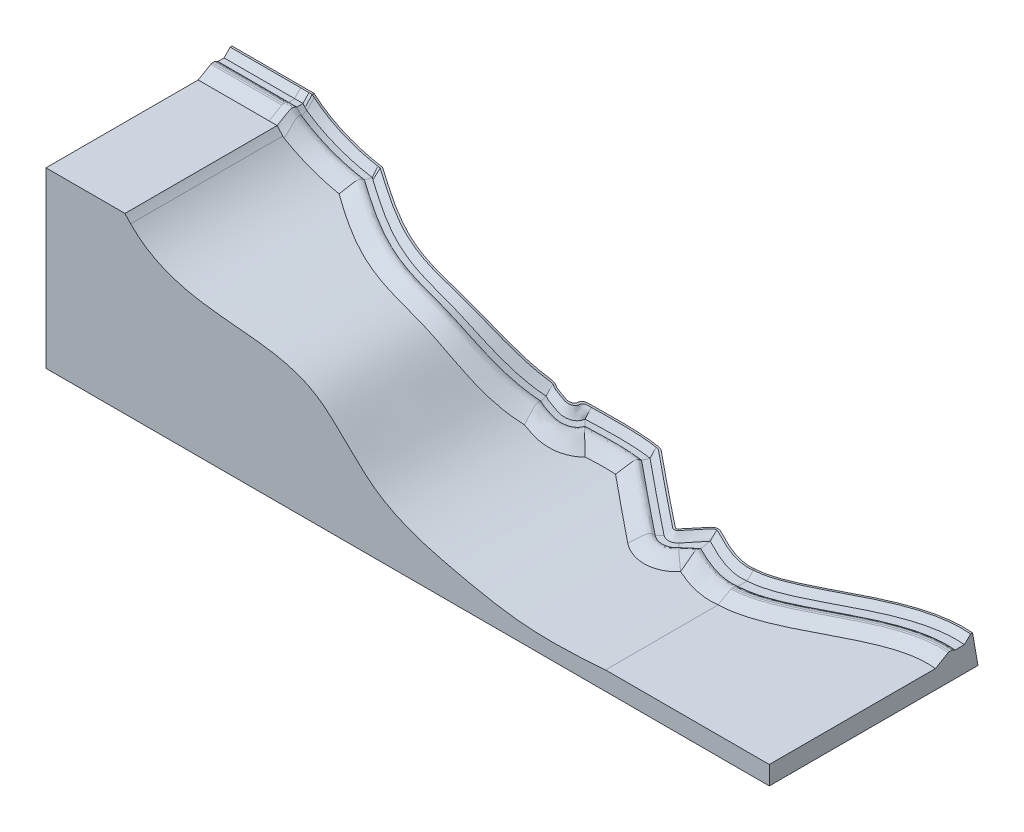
SolidWorks part; units mm, degrees
ref_plane "Ebene vorne" through (0, 0, 0) normal (0, 0, 1) x (1, 0, 0)
ref_plane "Ebene oben" through (0, 0, 0) normal (0, 1, 0) x (1, 0, 0)
ref_plane "Ebene rechts" through (0, 0, 0) normal (1, 0, 0) x (0, 0, -1)
imported_body "Imported1"
sketch "Skizze1" plane through (0, 10, 0) normal (0, 1, 0) x (1, 0, 0)
  line L0 (123.9386, 53.5483) -> (123.9386, 0) construction
  line L1 (71.135, 0) -> (123.9386, 0) construction
  line L2 (123.9386, 64.9193) -> (123.9386, 65.5214)
  line L3 (71.135, 48.2509) -> (71.135, 47.6501)
  line L4 (123.9386, 64.9193) -> (123.9386, 65.5214)
  line L5 (71.135, 48.2509) -> (71.135, 47.6501)
  line L6 (71.135, 0) -> (71.135, 47.6501) construction
  line L7 (123.9386, 57.6612) -> (123.9386, 53.5483) construction
  line L8 (123.9386, 57.6612) -> (123.9386, 58.163) construction
  line L9 (123.9386, 58.7632) -> (123.9386, 58.163) construction
  line L10 (123.9386, 58.7632) -> (123.9386, 59.265) construction
  line L11 (123.9386, 59.9013) -> (123.9386, 59.265) construction
  line L12 (123.9386, 62.9121) -> (123.9386, 59.9013) construction
  line L13 (123.9386, 64.9193) -> (123.9386, 62.9121) construction
  line L14 (123.9386, 53.5483) -> (123.9386, 0)
  line L15 (71.135, 0) -> (123.9386, 0)
  line L17 (123.9386, 57.6612) -> (123.9386, 53.5483)
  line L18 (123.9386, 57.6612) -> (123.9386, 58.163)
  line L19 (123.9386, 58.7632) -> (123.9386, 58.163)
  line L20 (123.9386, 58.7632) -> (123.9386, 59.265)
  line L21 (123.9386, 59.9013) -> (123.9386, 59.265)
  line L22 (123.9386, 62.9121) -> (123.9386, 59.9013)
  line L23 (123.9386, 64.9193) -> (123.9386, 62.9121)
  line L24 (71.135, 0) -> (71.135, 47.6501)
  spline S2 degree 3 poles (-893.4262, -2740.0063) (356.6354, -148.1156) (193.7863, 72.1931) (114.3015, 65.1888) (110.9592, 64.4009) (104.6442, 62.3469) (101.6631, 61.0794) (95.9651, 58.4023) (93.2467, 56.9903) (88.0371, 54.296) (85.5456, 53.0139) (80.8288, 50.8267) (78.605, 49.9248) (75.5485, 48.9856) (74.5767, 48.7405) (-2.8755, 34.0146) (275.7695, 501.2328) (-2867.1672, -415.4584) knots 0.127335 0.127335 0.127335 0.127335 0.799406 0.799406 0.830656 0.830656 0.861906 0.861906 0.893156 0.893156 0.924406 0.924406 0.955656 0.955656 0.971281 0.971281 2.269776 2.269776 2.269776 2.269776 only from (123.9386, 65.5214) to (71.135, 48.2509)
  spline S3 degree 3 poles (400.0002, 992.0245) (171.8435, 373.8027) (3.0518, 28.7539) (76.5386, 48.6505) (77.3941, 48.9215) (79.1598, 49.5481) (80.0698, 49.9038) (82.8715, 51.082) (84.8338, 52.0178) (88.9088, 54.0619) (91.0231, 55.17) (95.3948, 57.4165) (97.6551, 58.5539) (102.3449, 60.7065) (104.7754, 61.7202) (109.8566, 63.4408) (112.511, 64.1504) (165.1256, 72.3716) (255.9848, -9.695) (98.5967, -934.723) knots -5.379756 -5.379756 -5.379756 -5.379756 0.125 0.125 0.1875 0.1875 0.25 0.25 0.375 0.375 0.5 0.5 0.625 0.625 0.75 0.75 0.875 0.875 3.120839 3.120839 3.120839 3.120839 only from (71.135, 47.6501) to (123.9386, 64.9193)
  spline S4 degree 3 poles (123.9386, 65.5214) (121.8619, 65.6948) (119.8179, 65.6749) (114.3015, 65.1888) (110.9592, 64.4009) (104.6442, 62.3469) (101.6631, 61.0794) (95.9651, 58.4023) (93.2467, 56.9903) (88.0371, 54.296) (85.5456, 53.0139) (80.8288, 50.8267) (78.605, 49.9248) (75.5485, 48.9856) (74.5767, 48.7405) (72.7699, 48.397) (71.9316, 48.2931) (71.135, 48.2509) knots 0.781844 0.781844 0.781844 0.781844 0.799406 0.799406 0.830656 0.830656 0.861906 0.861906 0.893156 0.893156 0.924406 0.924406 0.955656 0.955656 0.971281 0.971281 0.986312 0.986312 0.986312 0.986312
  dimension "D1" = 0
extrude "Aufsatz-Linear austragen1" [suppressed] add sketch "Skizze1" against normal up to surface (4 mm away)
sketch "Skizze2" plane through (-109.2515, 0, 0) normal (-1, 0, 0) x (0, 0, 1)
  line L0 (-59.4, 60) -> (-60, 60)
  line L1 (-60, 60) -> (-60, 70)
  line L2 (-60, 70) -> (0, 70)
  line L3 (0, 70) -> (0, 60) construction
  line L4 (0, 56) -> (10, 56)
  line L5 (0, 70) -> (10, 70)
  line L6 (10, 70) -> (10, 56)
  line L8 (0, 56) -> (0, 60)
  line L9 (0, 60) -> (-59.4, 60)
  line L10 (-59.4, 60) -> (-57.4, 58)
  line L11 (-57.4, 58) -> (-55.4, 58)
  line L12 (-55.4, 58) -> (-54.766, 58.366)
  line L13 (-54.266, 58.5) -> (-53.6639, 58.5)
  line L14 (-53.1639, 58.366) -> (-49.0658, 56)
  line L15 (-49.0658, 56) -> (0, 56)
  line L16 (0, 56) -> (0, 60) construction
  line L17 (0, 60) -> (-59.4, 60) construction
  line L18 (-59.4, 60) -> (-57.4, 58)
  line L19 (-57.4, 58) -> (-55.4, 58)
  line L20 (-55.4, 58) -> (-54.766, 58.366)
  line L21 (-54.266, 58.5) -> (-53.6639, 58.5)
  line L22 (-53.1639, 58.366) -> (-49.0658, 56)
  line L23 (-49.0658, 56) -> (0, 56)
  arc A2 (-54.266, 58.5) -> (-54.766, 58.366) centre (-54.266, 57.5) ccw
  arc A3 (-53.1639, 58.366) -> (-53.6639, 58.5) centre (-53.6639, 57.5) ccw
  arc A4 (-54.266, 58.5) -> (-54.766, 58.366) centre (-54.266, 57.5) ccw
  arc A5 (-53.1639, 58.366) -> (-53.6639, 58.5) centre (-53.6639, 57.5) ccw
  dimension "D2" = 10
  dimension "D3" = 10
  dimension "D1" = 0
sketch3d "3D-Skizze1"
  line L0 (-109.2515, 60, -60) -> (-82.8362, 60, -60) construction
  line L1 (-109.2515, 60, -60) -> (-82.8362, 60, -60) construction
  spline S0 degree 3 poles (-1724.8086, -1000.7875, -247.0455) (610.0026, 1277.6327, 154.7015) (-202.4645, 161.8963, -42.0329) (-78.0357, 55.1095, -60.8623) (-77.2594, 54.5085, -60.9683) (-75.6387, 53.3799, -61.1673) (-74.7903, 52.8505, -61.2606) (-72.1971, 51.3994, -61.5165) (-70.3924, 50.6044, -61.6567) (-1.1166, 26.0474, -65.9868) (149.5272, 177.3713, -39.3043) (-1699.9642, -1082.5382, -261.4603) knots -20.569023 -20.569023 -20.569023 -20.569023 0.25 0.25 0.375 0.375 0.5 0.5 0.75 0.75 9.792761 9.792761 9.792761 9.792761 only from (-82.8362, 60, -60) to (-62.7908, 48.33, -62.0577) construction
  spline S1 degree 3 poles (-672.2557, 1620.0494, 1006.5175) (-161.4054, 104.3023, -158.2626) (-117.1067, 54.58, -96.087) (-52.5987, 46.7722, -55.5935) (-50.0067, 46.5375, -54.0238) (-46.0108, 46.1717, -51.8759) (-44.6607, 46.0475, -51.1947) (-41.9112, 45.7679, -49.9326) (-40.5119, 45.6128, -49.3515) (-38.3644, 45.3299, -48.5834) (-37.6404, 45.2271, -48.3447) (-36.1739, 44.9982, -47.9078) (-35.4303, 44.8718, -47.7096) (-33.2078, 44.4542, -47.1934) (-31.7259, 44.1233, -46.9506) (-29.5097, 43.5081, -46.758) (-28.7722, 43.2832, -46.7223) (-27.6695, 42.91, -46.7089) (-27.3016, 42.7793, -46.7111) (-26.5733, 42.507, -46.7284) (-26.2128, 42.3656, -46.7433) (-24.4294, 41.6303, -46.8473) (-23.0633, 40.9524, -47.0234) (-21.1121, 39.7776, -47.389) (-20.4778, 39.3601, -47.5279) (-19.2355, 38.4827, -47.8332) (-18.6284, 38.0232, -47.9997) (-16.8591, 36.6124, -48.5267) (-15.7397, 35.6232, -48.9165) (-13.5622, 33.6025, -49.7504) (-12.5044, 32.5706, -50.1947) (-10.4061, 30.5095, -51.1283) (-9.3657, 29.4801, -51.6176) (-7.2642, 27.4659, -52.6401) (-6.2032, 26.4811, -53.1735) (36.5514, -10.4484, -74.9357) (120.6982, 16.2952, -127.0429) (1490.8942, 1337.3212, 126.6217) knots -2.897233 -2.897233 -2.897233 -2.897233 0.125 0.125 0.25 0.25 0.3125 0.3125 0.375 0.375 0.40625 0.40625 0.4375 0.4375 0.5 0.5 0.53125 0.53125 0.546875 0.546875 0.5625 0.5625 0.625 0.625 0.65625 0.65625 0.6875 0.6875 0.75 0.75 0.8125 0.8125 0.875 0.875 0.9375 0.9375 3.326194 3.326194 3.326194 3.326194 only from (-62.7908, 48.33, -62.0577) to (-1.7331, 22.8655, -55.4505) construction
  spline S2 degree 3 poles (-1591.8235, 1042.4032, 591.579) (31.2175, 8.6291, 44.5751) (9.3574, 15.334, -56.0347) (-12.2395, 29.9774, -55.1997) (-20.6228, 45.0697, 62.0287) (1615.4495, -1149.5559, -97.8972) knots -21.324735 -21.324735 -21.324735 -21.324735 0.5 0.5 24.016037 24.016037 24.016037 24.016037 only from (-0.3256, 21.9112, -55.4972) to (-1.7331, 22.8655, -55.4505) construction
  spline S3 degree 3 poles (-1578.8474, 1137.8018, -551.4692) (1660.1021, -1118.0098, 168.6098) (-1681.5525, 1148.5191, -5.0975) (1647.2486, -1058.216, -381.5366) knots -46.397349 -46.397349 -46.397349 -46.397349 46.557012 46.557012 46.557012 46.557012 only from (0.5808, 21.3438, -55.3074) to (-0.3256, 21.9112, -55.4972) construction
  spline S4 degree 3 poles (-1002.7758, -1703.4354, -55.3074) (1318.6069, 1676.5782, -55.3074) (-1231.3353, -1668.6477, -55.3074) (938.5047, 1783.4542, -55.3074) knots -91.071429 -91.071429 -91.071429 -91.071429 74.888943 74.888943 74.888943 74.888943 only from (3.0081, 19.9804, -55.3074) to (0.5808, 21.3438, -55.3074) construction
  spline S5 degree 3 poles (-1785.339, 774.9633, -528.7279) (-148.6449, 90.4377, -124.6916) (8.2407, 17.5058, -71.4152) (4.9217, 19.0413, -56.7342) (4.8781, 19.0614, -56.6044) (4.7673, 19.1131, -56.3593) (4.7007, 19.1443, -56.2447) (4.5465, 19.217, -56.0303) (4.4591, 19.2585, -55.9315) (4.1772, 19.3934, -55.6682) (3.9578, 19.5001, -55.5324) (3.6122, 19.672, -55.3978) (3.4924, 19.7322, -55.3637) (-31.7834, 37.6607, -48.7654) (-141.9382, 151.0868, -1004.5748) (360.844, 1325.4839, -1417.1978) knots -13.709798 -13.709798 -13.709798 -13.709798 0.125 0.125 0.25 0.25 0.375 0.375 0.5 0.5 0.75 0.75 0.875 0.875 37.365409 37.365409 37.365409 37.365409 only from (5.0004, 19.0049, -57.2698) to (3.0081, 19.9804, -55.3074) construction
  spline S6 degree 3 poles (1737.7206, -879.0443, 379.1635) (150.8109, -47.0486, 5.6922) (0.1923, 21.2085, -43.1767) (5.1812, 18.9219, -58.1189) (5.2785, 18.8774, -58.3106) (13.6583, 15.0998, -70.3805) (123.2988, -31.4758, 10.1917) (-1271.5166, 758.5332, 1285.3435) knots -17.542614 -17.542614 -17.542614 -17.542614 0.25 0.25 0.5 0.5 17.480468 17.480468 17.480468 17.480468 only from (5.0004, 19.0049, -57.2698) to (6.3523, 18.4047, -59.2678) construction
  spline S7 degree 3 poles (-91.1336, 1574.0859, -1301.8325) (-64.6803, 106.7383, 105.7645) (-51.7348, 34.3702, -44.258) (16.5711, 14.961, -62.7749) (18.1043, 14.5608, -63.1166) (78.7026, -0.4573, -72.9522) (184.8799, -0.616, 43.1568) (-1230.6009, -108.9392, 1480.6441) knots -10.590032 -10.590032 -10.590032 -10.590032 0.5 0.5 0.75 0.75 10.19713 10.19713 10.19713 10.19713 only from (6.3523, 18.4047, -59.2678) to (24.4234, 13.0402, -63.8447) construction
  spline S8 degree 3 poles (572.103, 1881.5387, 361.5736) (285.7609, 168.7382, 138.863) (154.0062, -3.9842, 36.3871) (39.2744, 10.1702, -52.8487) (-72.1864, 26.6863, -139.5404) (-169.4399, 184.7427, -215.182) (-486.3805, -1863.1194, -461.6914) knots -16.236709 -16.236709 -16.236709 -16.236709 0.25 0.25 0.5 16.549555 16.549555 16.549555 16.549555 only from (46.1429, 9.458, -47.5065) to (25.6543, 12.7586, -63.4421) construction
  spline S9 degree 3 poles (1715.5391, -361.7997, 931.2351) (-1790.2179, 417.4327, -846.6813) (1918.7817, -410.8986, 490.0407) (-1900.1316, 445.2076, -371.1473) knots -27.750418 -27.750418 -27.750418 -27.750418 28.854972 28.854972 28.854972 28.854972 only from (24.4234, 13.0402, -63.8447) to (25.6543, 12.7586, -63.4421) construction
  spline S10 degree 3 poles (-1825.6109, 118.4739, 644.1953) (45.8319, 9.8909, -124.5921) (51.4348, 9.1059, -48.0212) (41.6157, 9.7579, -46.7923) (27.9744, 11.0928, -121.7435) (2028.1706, -132.1428, 171.8468) knots -18.529697 -18.529697 -18.529697 -18.529697 0.5 0.5 19.4269 19.4269 19.4269 19.4269 only from (46.8446, 9.4112, -47.5942) to (46.1429, 9.458, -47.5065) construction
  spline S11 degree 3 poles (364.6512, -1893.2814, -456.2028) (210.9132, 1956.3895, -258.5396) (-63.1704, -1946.5223, 93.8536) (-216.2581, 1945.046, 290.6806) knots -73.518441 -73.518441 -73.518441 -73.518441 63.892032 63.892032 63.892032 63.892032 only from (51.5028, 9.2194, -53.5833) to (46.8446, 9.4112, -47.5942) construction
  spline S12 degree 3 poles (1947.9879, -509.7238, 52.9502) (356.3661, 10.5037, 369.7722) (29.1616, 9.5836, -39.433) (52.2211, 9.2065, -54.1842) (52.4372, 9.2035, -54.2751) (52.8994, 9.1983, -54.3807) (53.1342, 9.1963, -54.3925) (76.4568, 9.0628, -51.4224) (-17.8586, 15.7007, 335.6567) (-463.3271, -162.0965, 1869.4805) knots -28.356633 -28.356633 -28.356633 -28.356633 0.25 0.25 0.5 0.5 0.75 0.75 25.324741 25.324741 25.324741 25.324741 only from (51.5028, 9.2194, -53.5833) to (54.037, 9.1929, -54.1528) construction
  spline S13 degree 3 poles (-943.2037, 340.231, 1643.2848) (-35.6217, 39.0037, -168.5126) (-1.4218, 7.648, -81.2749) (59.4832, 9.2849, -51.3986) (60.8659, 9.3391, -50.7587) (62.9854, 9.4441, -49.9006) (63.6995, 9.4831, -49.6314) (65.1496, 9.5688, -49.1419) (65.8825, 9.6154, -48.9235) (67.3571, 9.7148, -48.5651) (68.1003, 9.7678, -48.4238) (183.5978, 18.3563, -34.987) (517.0793, 97.8119, -1406.6739) (351.1977, -1468.2434, 1037.0152) knots -10.623288 -10.623288 -10.623288 -10.623288 0.25 0.25 0.5 0.5 0.625 0.625 0.75 0.75 0.875 0.875 19.956322 19.956322 19.956322 19.956322 only from (54.037, 9.1929, -54.1528) to (71.135, 10, -48.2509) construction
  spline S14 degree 3 poles (-1903.3914, 10, 148.8187) (215.754, 10, -399.0624) (6.0262, 10, -35.707) (74.5767, 10, -48.7405) (75.5485, 10, -48.9856) (78.605, 10, -49.9248) (80.8288, 10, -50.8267) (85.5456, 10, -53.0139) (88.0371, 10, -54.296) (93.2467, 10, -56.9903) (95.9651, 10, -58.4023) (101.6631, 10, -61.0794) (104.6442, 10, -62.3469) (110.9592, 10, -64.4009) (114.3015, 10, -65.1888) (183.7818, 10, -71.3115) (315.2424, 10, 94.0163) (-469.5695, 10, 1834.3413) knots -5.538426 -5.538426 -5.538426 -5.538426 0.073514 0.073514 0.149931 0.149931 0.302767 0.302767 0.455603 0.455603 0.608438 0.608438 0.761274 0.761274 0.91411 0.91411 3.768084 3.768084 3.768084 3.768084 only from (71.135, 10, -48.2509) to (123.9386, 10, -65.5214) construction
  spline S15 degree 3 poles (-82.8362, 60, -60) (-81.6139, 58.4418, -60.2748) (-80.2636, 57.0215, -60.5252) (-78.0357, 55.1095, -60.8623) (-77.2594, 54.5085, -60.9683) (-75.6387, 53.3799, -61.1673) (-74.7903, 52.8505, -61.2606) (-72.1971, 51.3994, -61.5165) (-70.3924, 50.6044, -61.6567) (-66.665, 49.2831, -61.8897) (-64.7377, 48.7563, -61.9826) (-62.7908, 48.33, -62.0577) knots 0 0 0 0 0.25 0.25 0.375 0.375 0.5 0.5 0.75 0.75 1 1 1 1 construction
  spline S16 degree 3 poles (-62.7908, 48.33, -62.0577) (-60.2548, 47.7747, -60.4582) (-57.7229, 47.3924, -58.8101) (-52.5987, 46.7722, -55.5935) (-50.0067, 46.5375, -54.0238) (-46.0108, 46.1717, -51.8759) (-44.6607, 46.0475, -51.1947) (-41.9112, 45.7679, -49.9326) (-40.5119, 45.6128, -49.3515) (-38.3644, 45.3299, -48.5834) (-37.6404, 45.2271, -48.3447) (-36.1739, 44.9982, -47.9078) (-35.4303, 44.8718, -47.7096) (-33.2078, 44.4542, -47.1934) (-31.7259, 44.1233, -46.9506) (-29.5097, 43.5081, -46.758) (-28.7722, 43.2832, -46.7223) (-27.6695, 42.91, -46.7089) (-27.3016, 42.7793, -46.7111) (-26.5733, 42.507, -46.7284) (-26.2128, 42.3656, -46.7433) (-24.4294, 41.6303, -46.8473) (-23.0633, 40.9524, -47.0234) (-21.1121, 39.7776, -47.389) (-20.4778, 39.3601, -47.5279) (-19.2355, 38.4827, -47.8332) (-18.6284, 38.0232, -47.9997) (-16.8591, 36.6124, -48.5267) (-15.7397, 35.6232, -48.9165) (-13.5622, 33.6025, -49.7504) (-12.5044, 32.5706, -50.1947) (-10.4061, 30.5095, -51.1283) (-9.3657, 29.4801, -51.6176) (-7.2642, 27.4659, -52.6401) (-6.2032, 26.4811, -53.1735) (-4.023, 24.5978, -54.2833) (-2.9037, 23.6992, -54.8593) (-1.7331, 22.8655, -55.4505) knots 0 0 0 0 0.125 0.125 0.25 0.25 0.3125 0.3125 0.375 0.375 0.40625 0.40625 0.4375 0.4375 0.5 0.5 0.53125 0.53125 0.546875 0.546875 0.5625 0.5625 0.625 0.625 0.65625 0.65625 0.6875 0.6875 0.75 0.75 0.8125 0.8125 0.875 0.875 0.9375 0.9375 1 1 1 1 construction
  spline S17 degree 3 poles (-0.3256, 21.9112, -55.4972) (-0.5559, 22.0598, -55.5981) (-0.8001, 22.2211, -55.6419) (-1.2764, 22.5441, -55.6235) (-1.5133, 22.7089, -55.5615) (-1.7331, 22.8655, -55.4505) knots 0 0 0 0 0.5 0.5 1 1 1 1 construction
  spline S18 degree 3 poles (0.5808, 21.3438, -55.3074) (0.2693, 21.533, -55.3074) (-0.0384, 21.7258, -55.371) (-0.3256, 21.9112, -55.4972) knots 0 0 0 0 1 1 1 1 construction
  spline S19 degree 3 poles (3.0081, 19.9804, -55.3074) (2.1841, 20.4086, -55.3074) (1.3743, 20.8621, -55.3074) (0.5808, 21.3438, -55.3074) knots 0 0 0 0 1 1 1 1 construction
  spline S20 degree 3 poles (5.0004, 19.0049, -57.2698) (4.9978, 19.0061, -57.1317) (4.9811, 19.0138, -56.9971) (4.9217, 19.0413, -56.7342) (4.8781, 19.0614, -56.6044) (4.7673, 19.1131, -56.3593) (4.7007, 19.1443, -56.2447) (4.5465, 19.217, -56.0303) (4.4591, 19.2585, -55.9315) (4.1772, 19.3934, -55.6682) (3.9578, 19.5001, -55.5324) (3.6122, 19.672, -55.3978) (3.4924, 19.7322, -55.3637) (3.2516, 19.8546, -55.3186) (3.1303, 19.9169, -55.3074) (3.0081, 19.9804, -55.3074) knots 0 0 0 0 0.125 0.125 0.25 0.25 0.375 0.375 0.5 0.5 0.75 0.75 0.875 0.875 1 1 1 1 construction
  spline S21 degree 3 poles (5.0004, 19.0049, -57.2698) (5.0045, 19.003, -57.4911) (5.0429, 18.9852, -57.7049) (5.1812, 18.9219, -58.1189) (5.2785, 18.8774, -58.3106) (5.6433, 18.713, -58.8359) (5.9743, 18.5662, -59.106) (6.3523, 18.4047, -59.2678) knots 0 0 0 0 0.25 0.25 0.5 0.5 1 1 1 1 construction
  spline S22 degree 3 poles (6.3523, 18.4047, -59.2678) (9.1513, 17.209, -60.4657) (12.0535, 16.2447, -61.5503) (16.5711, 14.961, -62.7749) (18.1043, 14.5608, -63.1166) (21.2289, 13.7865, -63.6238) (22.8242, 13.4094, -63.7893) (24.4234, 13.0402, -63.8447) knots 0 0 0 0 0.5 0.5 0.75 0.75 1 1 1 1 construction
  spline S23 degree 3 poles (46.1429, 9.458, -47.5065) (44.4201, 9.5788, -48.8465) (42.702, 9.7473, -50.1828) (39.2744, 10.1702, -52.8487) (34.1457, 10.9301, -56.8377) (29.0471, 11.9898, -60.8033) (25.6543, 12.7586, -63.4421) knots 0 0 0 0 0.25 0.25 0.5 1 1 1 1 construction
  spline S24 degree 3 poles (24.4234, 13.0402, -63.8447) (24.8648, 12.9383, -63.86) (25.3022, 12.8384, -63.716) (25.6543, 12.7586, -63.4421) knots 0 0 0 0 1 1 1 1 construction
  spline S25 degree 3 poles (46.8446, 9.4112, -47.5942) (46.7634, 9.4163, -47.4899) (46.6413, 9.4242, -47.4213) (46.3826, 9.4413, -47.3889) (46.2472, 9.4506, -47.4254) (46.1429, 9.458, -47.5065) knots 0 0 0 0 0.5 0.5 1 1 1 1 construction
  spline S26 degree 3 poles (51.5028, 9.2194, -53.5833) (49.9495, 9.2514, -51.5863) (48.3968, 9.3133, -49.5899) (46.8446, 9.4112, -47.5942) knots 0 0 0 0 1 1 1 1 construction
  spline S27 degree 3 poles (51.5028, 9.2194, -53.5833) (51.6485, 9.2164, -53.7706) (51.8215, 9.2131, -53.9286) (52.2211, 9.2065, -54.1842) (52.4372, 9.2035, -54.2751) (52.8994, 9.1983, -54.3807) (53.1342, 9.1963, -54.3925) (53.604, 9.1937, -54.3327) (53.8267, 9.193, -54.263) (54.037, 9.1929, -54.1528) knots 0 0 0 0 0.25 0.25 0.5 0.5 0.75 0.75 1 1 1 1 construction
  spline S28 degree 3 poles (54.037, 9.1929, -54.1528) (55.39, 9.1919, -53.4437) (56.7455, 9.2113, -52.7416) (59.4832, 9.2849, -51.3986) (60.8659, 9.3391, -50.7587) (62.9854, 9.4441, -49.9006) (63.6995, 9.4831, -49.6314) (65.1496, 9.5688, -49.1419) (65.8825, 9.6154, -48.9235) (67.3571, 9.7148, -48.5651) (68.1003, 9.7678, -48.4238) (69.6037, 9.8796, -48.2489) (70.3647, 9.9385, -48.2209) (71.135, 10, -48.2509) knots 0 0 0 0 0.25 0.25 0.5 0.5 0.625 0.625 0.75 0.75 0.875 0.875 1 1 1 1 construction
  spline S29 degree 3 poles (71.135, 10, -48.2509) (71.9316, 10, -48.2931) (72.7699, 10, -48.397) (74.5767, 10, -48.7405) (75.5485, 10, -48.9856) (78.605, 10, -49.9248) (80.8288, 10, -50.8267) (85.5456, 10, -53.0139) (88.0371, 10, -54.296) (93.2467, 10, -56.9903) (95.9651, 10, -58.4023) (101.6631, 10, -61.0794) (104.6442, 10, -62.3469) (110.9592, 10, -64.4009) (114.3015, 10, -65.1888) (119.8179, 10, -65.6749) (121.8619, 10, -65.6948) (123.9386, 10, -65.5214) knots 0 0 0 0 0.073514 0.073514 0.149931 0.149931 0.302767 0.302767 0.455603 0.455603 0.608438 0.608438 0.761274 0.761274 0.91411 0.91411 1 1 1 1 construction
  spline S30 degree 3 number of poles 213 (-109.2515, 60, -60) -> (123.9386, 10, -65.5214)
sweep "Schnitt-Austragung1" [suppressed] cut profiles "Skizze2" path "3D-Skizze1"
sketch "Sketch1" plane through (0, 56, 0) normal (0, 1, 0) x (1, 0, 0)
  line L3 (-109.2515, 59.4) -> (-82.8362, 59.4) construction
  line L4 (-109.2515, 59.4) -> (-82.7694, 59.4)
  line L6 (47.3182, 47.2259) -> (51.9764, 53.215)
  line L7 (25.2859, 62.9685) -> (45.7746, 47.0329)
  line L8 (0.5808, 54.7074) -> (3.0081, 54.7074)
  line L9 (47.3182, 47.2259) -> (51.9764, 53.215)
  line L10 (25.2859, 62.9685) -> (45.7746, 47.0329)
  line L11 (0.5808, 54.7074) -> (3.0081, 54.7074)
  arc A2 (45.7746, 47.0329) -> (47.3182, 47.2259) centre (46.4499, 47.9012) ccw
  arc A3 (45.7746, 47.0329) -> (47.3182, 47.2259) centre (46.4499, 47.9012) ccw
  spline S20 degree 3 poles (-1458.8301, -2531.6947) (-36.934, 190.2839) (-10.512, 85.0657) (59.2271, 50.856) (60.6228, 50.2098) (62.7692, 49.3408) (63.494, 49.0674) (64.9713, 48.5689) (65.7212, 48.3452) (66.8565, 48.0693) (67.2376, 47.9868) (68.0056, 47.845) (68.391, 47.786) (177.7445, 35.0639) (461.9838, 1223.327) (-2458.1067, -1403.2197) knots -12.161737 -12.161737 -12.161737 -12.161737 0.25 0.25 0.5 0.5 0.625 0.625 0.75 0.75 0.8125 0.8125 0.875 0.875 18.264242 18.264242 18.264242 18.264242 only from (53.7585, 53.6213) to (71.1583, 47.6513)
  spline S21 degree 3 poles (-1849.1746, -2264.2459) (138.284, -44.2375) (42.5795, 47.3042) (52.4877, 53.6425) (52.6378, 53.7055) (52.966, 53.7804) (53.1271, 53.7886) (63.4209, 52.4777) (16.5524, -45.6516) (2770.8879, -1213.9563) knots -16.810782 -16.810782 -16.810782 -16.810782 0.25 0.25 0.5 0.5 0.75 0.75 15.983122 15.983122 15.983122 15.983122 only from (51.9764, 53.215) to (53.7585, 53.6213)
  spline S22 degree 3 poles (2832.3883, -984.2767) (-31.4571, -64.8234) (14.4159, 66.6113) (24.957, 63.1582) (25.0268, 63.1285) (25.1274, 63.0751) (25.1767, 63.0461) (25.2321, 63.0086) (25.2592, 62.9888) (25.2707, 62.9802) (25.5706, 62.7522) (15.4796, 70.4079) (2391.4723, -1778.0176) knots -36.101488 -36.101488 -36.101488 -36.101488 0.5 0.5 0.75 0.75 0.875 0.9375 0.96875 0.984375 0.984375 2.196032 2.196032 2.196032 2.196032 only from (24.4441, 63.245) to (25.2859, 62.9685)
  spline S23 degree 3 poles (-118.7305, 3053.8849) (-73.3647, -212.3974) (-71.5187, 38.2732) (16.7103, 62.191) (18.2233, 62.5281) (86.432, 73.5989) (211.0995, -78.8257) (-2008.0558, -2130.4793) knots -14.072648 -14.072648 -14.072648 -14.072648 0.5 0.5 0.75 0.75 11.577116 11.577116 11.577116 11.577116 only from (6.5884, 58.7162) to (24.4441, 63.245)
  spline S24 degree 3 poles (319.0637, -2924.534) (114.5787, 42.2277) (2.1393, 47.1136) (5.7322, 57.8746) (5.8028, 58.0136) (13.8675, 69.6297) (143.7535, -42.8988) (-2425.4288, -1690.9796) knots -17.117583 -17.117583 -17.117583 -17.117583 0.25 0.25 0.5 0.5 22.609949 22.609949 22.609949 22.609949 only from (5.6003, 57.2585) to (6.5884, 58.7162)
  spline S25 degree 3 poles (3002.6917, 55.0823) (-8.4823, 54.8331) (2.5472, 54.7047) (3.028, 54.7075) (3.0429, 54.7076) (3.0776, 54.7082) (3.1471, 54.7106) (3.2065, 54.7147) (3.3252, 54.7257) (3.4036, 54.7367) (3.6397, 54.7808) (3.7944, 54.8249) (4.2464, 55.0008) (4.5295, 55.1763) (4.8972, 55.5197) (5.0107, 55.6481) (5.2106, 55.926) (5.2971, 56.0747) (5.4417, 56.3946) (5.4981, 56.563) (5.5559, 56.8186) (5.571, 56.9051) (5.587, 57.0365) (5.5933, 57.1026) (5.5978, 57.1804) (5.5993, 57.2194) (5.5998, 57.2361) (5.6129, 57.7583) (5.6792, 69.2326) (-51.2436, -2942.0385) knots -0.370356 -0.370356 -0.370356 -0.370356 0.003906 0.003906 0.007813 0.015625 0.03125 0.0625 0.0625 0.125 0.125 0.25 0.25 0.5 0.5 0.625 0.625 0.75 0.75 0.875 0.875 0.9375 0.9375 0.96875 0.984375 0.992188 0.996094 0.996094 1.357432 1.357432 1.357432 1.357432 only from (3.0081, 54.7074) to (5.6003, 57.2585)
  spline S26 degree 3 poles (2981.31, 322.8252) (-2.9138, 253.6927) (-18.7734, 58.6833) (0.0921, 54.7475) (0.1892, 54.7325) (0.3356, 54.7174) (0.409, 54.7118) (0.4948, 54.7085) (0.5378, 54.7077) (0.5562, 54.7075) (1.1316, 54.7038) (12.5907, 54.8685) (-2998.1633, 55.1587) knots -48.295517 -48.295517 -48.295517 -48.295517 0.5 0.5 0.75 0.75 0.875 0.9375 0.96875 0.984375 0.984375 2.43278 2.43278 2.43278 2.43278 only from (-0.567, 54.9478) to (0.5808, 54.7074)
  spline S27 degree 3 poles (2915.3665, -631.6402) (-34.0616, -88.9932) (-10.8227, 54.6521) (8.5518, 55.4049) (32.0861, -79.6808) (-2690.8689, -1265.9839) knots -32.292856 -32.292856 -32.292856 -32.292856 0.5 0.5 32.489077 32.489077 32.489077 32.489077 only from (-1.4626, 54.9149) to (-0.567, 54.9478)
  spline S28 degree 3 poles (-1331.2164, -2650.3407) (-183.9052, 200.4599) (-138.2681, 108.5935) (-52.7779, 54.9997) (-50.1795, 53.4301) (-46.1629, 51.2794) (-44.8036, 50.5967) (-42.0315, 49.3313) (-40.6182, 48.7482) (-38.4452, 47.9774) (-37.712, 47.7379) (-36.225, 47.2995) (-35.4714, 47.1009) (-33.2167, 46.5845) (-31.7103, 46.3423) (-29.4548, 46.1535) (-28.7048, 46.1195) (-27.2092, 46.1055) (-26.466, 46.1259) (-24.2946, 46.2578) (-22.9089, 46.4394) (-20.9309, 46.8139) (-20.2883, 46.9556) (-19.0307, 47.2668) (-18.4167, 47.436) (-16.6293, 47.9706) (-15.4992, 48.3654) (-13.3052, 49.2072) (-12.2407, 49.6549) (-10.1327, 50.5936) (-9.089, 51.0849) (-6.9832, 52.1097) (-5.9215, 52.6436) (-4.2879, 53.4752) (-3.7367, 53.7574) (38.0192, 75.0855) (123.296, 115.4217) (2932.0193, 681.6594) knots -3.92073 -3.92073 -3.92073 -3.92073 0.125 0.125 0.25 0.25 0.3125 0.3125 0.375 0.375 0.40625 0.40625 0.4375 0.4375 0.5 0.5 0.53125 0.53125 0.5625 0.5625 0.625 0.625 0.65625 0.65625 0.6875 0.6875 0.75 0.75 0.8125 0.8125 0.875 0.875 0.9375 0.9375 0.96875 0.96875 3.264749 3.264749 3.264749 3.264749 only from (-62.9535, 61.4509) to (-1.4626, 54.9149)
  spline S29 degree 3 poles (-2831.136, 1255.4643) (1018.9064, -240.8705) (-227.3712, 37.5834) (-77.9941, 60.2621) (-77.2308, 60.3668) (-75.6365, 60.5635) (-74.8013, 60.656) (-72.245, 60.9101) (-70.4647, 61.0497) (12.0055, 66.2627) (216.2177, 26.7564) (-3041.0953, 421.6278) knots -25.214799 -25.214799 -25.214799 -25.214799 0.25 0.25 0.375 0.375 0.5 0.5 0.75 0.75 11.704145 11.704145 11.704145 11.704145 only from (-82.7046, 59.4146) to (-62.9535, 61.4509)
  spline S30 degree 3 poles (53.7585, 53.6213) (55.1132, 52.9114) (56.4732, 52.2069) (59.2271, 50.856) (60.6228, 50.2098) (62.7692, 49.3408) (63.494, 49.0674) (64.9713, 48.5689) (65.7212, 48.3452) (66.8565, 48.0693) (67.2376, 47.9868) (68.0056, 47.845) (68.391, 47.786) (69.5659, 47.6493) (70.3582, 47.6202) (71.1583, 47.6513) knots 0 0 0 0 0.25 0.25 0.5 0.5 0.625 0.625 0.75 0.75 0.8125 0.8125 0.875 0.875 1 1 1 1
  spline S31 degree 3 poles (51.9764, 53.215) (52.0811, 53.3496) (52.2015, 53.4594) (52.4877, 53.6425) (52.6378, 53.7055) (52.966, 53.7804) (53.1271, 53.7886) (53.4595, 53.7462) (53.6104, 53.699) (53.7585, 53.6213) knots 0 0 0 0 0.25 0.25 0.5 0.5 0.75 0.75 1 1 1 1
  spline S32 degree 3 poles (24.4441, 63.245) (24.5929, 63.2502) (24.7425, 63.2285) (24.957, 63.1582) (25.0268, 63.1285) (25.1274, 63.0751) (25.1767, 63.0461) (25.2321, 63.0086) (25.2592, 62.9888) (25.2707, 62.9802) (25.2783, 62.9744) (25.2804, 62.9728) (25.2859, 62.9685) knots 0 0 0 0 0.5 0.5 0.75 0.75 0.875 0.9375 0.96875 0.984375 0.984375 1 1 1 1
  spline S33 degree 3 poles (6.5884, 58.7162) (9.3698, 59.9066) (12.246, 60.9808) (16.7103, 62.191) (18.2233, 62.5281) (21.3021, 63.0278) (22.8725, 63.1906) (24.4441, 63.245) knots 0 0 0 0 0.5 0.5 0.75 0.75 1 1 1 1
  spline S34 degree 3 poles (5.6003, 57.2585) (5.6033, 57.4177) (5.6302, 57.5692) (5.7322, 57.8746) (5.8028, 58.0136) (6.0733, 58.4033) (6.316, 58.5996) (6.5884, 58.7162) knots 0 0 0 0 0.25 0.25 0.5 0.5 1 1 1 1
  spline S35 degree 3 poles (3.0081, 54.7074) (3.0119, 54.7074) (3.018, 54.7074) (3.028, 54.7075) (3.0429, 54.7076) (3.0776, 54.7082) (3.1471, 54.7106) (3.2065, 54.7147) (3.3252, 54.7257) (3.4036, 54.7367) (3.6397, 54.7808) (3.7944, 54.8249) (4.2464, 55.0008) (4.5295, 55.1763) (4.8972, 55.5197) (5.0107, 55.6481) (5.2106, 55.926) (5.2971, 56.0747) (5.4417, 56.3946) (5.4981, 56.563) (5.5559, 56.8186) (5.571, 56.9051) (5.587, 57.0365) (5.5933, 57.1026) (5.5978, 57.1804) (5.5993, 57.2194) (5.5998, 57.2361) (5.6, 57.2473) (5.6002, 57.2542) (5.6003, 57.2585) knots 0 0 0 0 0.003906 0.003906 0.007813 0.015625 0.03125 0.0625 0.0625 0.125 0.125 0.25 0.25 0.5 0.5 0.625 0.625 0.75 0.75 0.875 0.875 0.9375 0.9375 0.96875 0.984375 0.992188 0.996094 0.996094 1 1 1 1
  spline S36 degree 3 poles (-0.567, 54.9478) (-0.3851, 54.8679) (-0.1964, 54.8077) (0.0921, 54.7475) (0.1892, 54.7325) (0.3356, 54.7174) (0.409, 54.7118) (0.4948, 54.7085) (0.5378, 54.7077) (0.5562, 54.7075) (0.5685, 54.7074) (0.5759, 54.7074) (0.5808, 54.7074) knots 0 0 0 0 0.5 0.5 0.75 0.75 0.875 0.9375 0.96875 0.984375 0.984375 1 1 1 1
  spline S37 degree 3 poles (-1.4626, 54.9149) (-1.3174, 54.9882) (-1.1648, 55.0274) (-0.8657, 55.039) (-0.7128, 55.0117) (-0.567, 54.9478) knots 0 0 0 0 0.5 0.5 1 1 1 1
  spline S38 degree 3 poles (-62.9535, 61.4509) (-60.4289, 59.8565) (-57.9023, 58.2122) (-52.7779, 54.9997) (-50.1795, 53.4301) (-46.1629, 51.2794) (-44.8036, 50.5967) (-42.0315, 49.3313) (-40.6182, 48.7482) (-38.4452, 47.9774) (-37.712, 47.7379) (-36.225, 47.2995) (-35.4714, 47.1009) (-33.2167, 46.5845) (-31.7103, 46.3423) (-29.4548, 46.1535) (-28.7048, 46.1195) (-27.2092, 46.1055) (-26.466, 46.1259) (-24.2946, 46.2578) (-22.9089, 46.4394) (-20.9309, 46.8139) (-20.2883, 46.9556) (-19.0307, 47.2668) (-18.4167, 47.436) (-16.6293, 47.9706) (-15.4992, 48.3654) (-13.3052, 49.2072) (-12.2407, 49.6549) (-10.1327, 50.5936) (-9.089, 51.0849) (-6.9832, 52.1097) (-5.9215, 52.6436) (-4.2879, 53.4752) (-3.7367, 53.7574) (-2.6153, 54.3301) (-2.0464, 54.6201) (-1.4626, 54.9149) knots 0 0 0 0 0.125 0.125 0.25 0.25 0.3125 0.3125 0.375 0.375 0.40625 0.40625 0.4375 0.4375 0.5 0.5 0.53125 0.53125 0.5625 0.5625 0.625 0.625 0.65625 0.65625 0.6875 0.6875 0.75 0.75 0.8125 0.8125 0.875 0.875 0.9375 0.9375 0.96875 0.96875 1 1 1 1
  spline S39 degree 3 poles (-82.7694, 59.4) (-81.5559, 59.6747) (-80.2095, 59.9258) (-77.9941, 60.2621) (-77.2308, 60.3668) (-75.6365, 60.5635) (-74.8013, 60.656) (-72.245, 60.9101) (-70.4647, 61.0497) (-66.7844, 61.2823) (-64.8798, 61.3754) (-62.9535, 61.4509) knots -0.004518 -0.004518 -0.004518 -0.004518 0.25 0.25 0.375 0.375 0.5 0.5 0.75 0.75 1 1 1 1
  dimension "D1" = 0.6
surface "Surface-Extrude1" sketch "Sketch1" parameters "D1"=10, "D2"=66
ref_plane "Plane1" through (0, 66, 0) normal (0, 1, 0) x (-1, 0, 0)
sketch "Sketch2" plane through (0, 66, 0) normal (0, 1, 0) x (-1, 0, 0)
  line L6 (82.7694, -59.4) -> (82.8362, -59.3849)
  line L7 (82.8362, -59.3849) -> (82.8362, 0)
  line L8 (82.8362, 0) -> (-71.135, 0)
  line L9 (-71.135, 0) -> (-71.135, -47.6501)
  line L10 (-71.135, -47.6501) -> (-71.135, -47.6504)
  line L11 (-3.0081, -54.7074) -> (-0.5808, -54.7074)
  line L12 (82.7694, -59.4) -> (82.8362, -59.3849)
  line L13 (82.8362, -59.3849) -> (82.8362, 0)
  line L14 (82.8362, 0) -> (-71.135, 0)
  line L15 (-71.135, 0) -> (-71.135, -47.6501)
  line L16 (-71.135, -47.6501) -> (-71.135, -47.6504)
  line L17 (-3.0081, -54.7074) -> (-0.5808, -54.7074)
  spline S13 degree 3 poles (2462.6398, -1860.2349) (-64.7507, -48.2635) (13.1936, -63.8253) (65.8876, -61.3217) (67.2769, -61.248) (68.6557, -61.1657) (70.0253, -61.0739) (71.3859, -60.9714) (72.6941, -60.861) (73.7044, -60.7659) (74.4405, -60.6912) (74.9224, -60.6401) (75.3974, -60.5876) (75.8656, -60.5338) (76.3269, -60.4784) (76.7814, -60.4217) (77.2289, -60.3636) (77.6696, -60.304) (78.1033, -60.243) (78.5301, -60.1806) (78.9501, -60.1167) (79.3631, -60.0514) (79.7692, -59.9848) (80.1684, -59.9167) (80.5608, -59.8471) (80.9462, -59.7762) (81.3248, -59.7038) (81.6966, -59.63) (82.0615, -59.5548) (96.879, -56.3908) (86.4994, -49.4998) (3051.7691, -487.9055) knots -6.773024 -6.773024 -6.773024 -6.773024 0.065647 0.129303 0.191019 0.250855 0.315148 0.378104 0.439829 0.500433 0.524463 0.548416 0.572301 0.596126 0.6199 0.64363 0.667326 0.690995 0.714646 0.738287 0.761928 0.785575 0.809237 0.832922 0.856638 0.880393 0.904194 0.928048 0.951963 0.975945 3.901228 3.901228 3.901228 3.901228 only from (62.9535, -61.4509) to (82.7694, -59.4)
  spline S14 degree 3 poles (-131.3854, 2951.1511) (-108.0817, -90.6717) (-88.9884, -46.8869) (-69.5732, -47.6633) (-68.6855, -47.7419) (-67.6685, -47.8958) (-66.5496, -48.1339) (-65.4236, -48.4347) (-64.3319, -48.7775) (-63.2299, -49.1676) (-61.787, -49.7271) (-59.9983, -50.4991) (-57.8983, -51.498) (-56.1964, -52.3556) (-3.9877, -79.3129) (37.2272, -126.0277) (1463.3074, 2531.1156) knots -3.015699 -3.015699 -3.015699 -3.015699 0.042379 0.084346 0.126006 0.186501 0.250559 0.310868 0.374823 0.435397 0.499679 0.624733 0.749805 0.874901 0.932183 10.228395 10.228395 10.228395 10.228395 only from (-71.135, -47.6504) to (-53.7585, -53.6213)
  spline S15 degree 3 poles (-1204.2876, -2824.1644) (-49.8062, -18.2299) (-58.3228, -52.2584) (-53.4512, -53.7412) (-53.2616, -53.7763) (-53.04, -53.7841) (-52.7938, -53.7483) (-52.5568, -53.6713) (-52.3735, -53.5736) (-52.2381, -53.4783) (-52.1433, -53.3985) (-48.7849, -50.0797) (-66.4858, -28.0859) (2198.6724, -2036.5072) knots -7.42685 -7.42685 -7.42685 -7.42685 0.083315 0.166214 0.249913 0.374518 0.499895 0.624514 0.749817 0.812501 0.874792 0.937142 7.944872 7.944872 7.944872 7.944872 only from (-53.7585, -53.6213) to (-51.9764, -53.215)
  spline S16 degree 3 poles (1616.8818, 2439.2776) (-413.6093, -518.8171) (-229.8822, -281.9461) (-50.0127, -50.6903) (-49.081, -49.4924) (59.0305, 89.5114) (162.8771, 222.7499) (1743.2498, 2359.6258) knots -115.200767 -115.200767 -115.200767 -115.200767 0.216111 0.424164 0.624161 0.816105 70.05891 70.05891 70.05891 70.05891 only from (-51.9764, -53.215) to (-47.3182, -47.2259)
  spline S17 degree 3 poles (-2104.0427, 2136.6003) (-24.1253, -86.5401) (-51.3126, -49.8994) (-46.9958, -46.9388) (-46.7981, -46.8498) (-46.5864, -46.8028) (-46.3698, -46.7966) (-46.1916, -46.8279) (-46.0548, -46.8726) (-45.9561, -46.9162) (-42.3841, -48.9113) (-54.408, -74.5113) (1614.7234, 2451.4404) knots -8.631389 -8.631389 -8.631389 -8.631389 0.125221 0.250482 0.375257 0.500072 0.62492 0.749778 0.812654 0.874911 0.937156 7.909203 7.909203 7.909203 7.909203 only from (-47.3182, -47.2259) to (-45.7746, -47.0329)
  spline S18 degree 3 poles (2399.1128, -1785.3666) (-280.3569, 134.5899) (-154.5606, 37.581) (-42.3741, -49.6777) (-40.4054, -51.209) (-38.1033, -52.9994) (-35.7297, -54.8457) (-33.1204, -56.8748) (-30.7506, -58.7182) (-28.48, -60.4843) (71.7318, -138.4269) (161.529, -207.7475) (2289.3057, -1971.3041) knots -16.082722 -16.082722 -16.082722 -16.082722 0.080604 0.163985 0.250166 0.367548 0.500039 0.597374 0.749938 0.848032 0.931405 15.508317 15.508317 15.508317 15.508317 only from (-45.7746, -47.0329) to (-25.2859, -62.9685)
  spline S19 degree 3 poles (-1490.54, -2680.6581) (-13.6018, -19.8166) (-30.0878, -61.0401) (-24.9235, -63.1723) (-24.7785, -63.2136) (-24.6677, -63.2345) (-20.3728, -63.6813) (-15.1901, -36.4761) (-112.1852, -3061.9088) knots -17.772464 -17.772464 -17.772464 -17.772464 0.250257 0.500939 0.626929 0.751483 0.875527 14.984646 14.984646 14.984646 14.984646 only from (-25.2859, -62.9685) to (-24.4441, -63.245)
  spline S20 degree 3 poles (129.1062, -3058.549) (-82.887, -24.4788) (-50.9812, -65.568) (-22.1295, -63.0944) (-20.9556, -62.9593) (-19.4154, -62.7332) (-17.4904, -62.3646) (-15.2493, -61.8135) (-13.0078, -61.1504) (-11.3642, -60.5914) (-10.245, -60.182) (-9.67, -59.9657) (-9.0803, -59.7382) (-8.4761, -59.4993) (-7.8581, -59.2489) (21.1599, -47.2433) (32.3065, -20.2196) (2325.6854, -1944.4938) knots -4.441502 -4.441502 -4.441502 -4.441502 0.061183 0.123242 0.186227 0.250165 0.372398 0.50037 0.62135 0.750195 0.782695 0.816259 0.850887 0.886576 0.923326 0.961134 6.095278 6.095278 6.095278 6.095278 only from (-24.4441, -63.245) to (-6.5884, -58.7162)
  spline S21 degree 3 poles (1307.0888, -2755.6164) (-34.3071, -28.1302) (-11.0564, -62.0046) (-6.2009, -58.4855) (-6.0341, -58.3286) (-5.8891, -58.1471) (-5.7687, -57.9463) (-5.6922, -57.7634) (-5.647, -57.6114) (-5.6218, -57.4944) (-4.969, -52.8727) (-31.071, -45.7022) (2981.5982, -332.617) knots -9.515342 -9.515342 -9.515342 -9.515342 0.125437 0.250805 0.375856 0.500449 0.626493 0.7503 0.813963 0.876512 0.938377 8.121107 8.121107 8.121107 8.121107 only from (-6.5884, -58.7162) to (-5.6003, -57.2585)
  spline S22 degree 3 poles (-2986.2483, 281.1164) (30.9191, -75.9551) (-6.8629, -64.0247) (-5.5397, -56.7279) (-5.4681, -56.4728) (-5.3392, -56.1471) (-5.12, -55.771) (-4.7808, -55.3887) (-4.4495, -55.1362) (-4.1643, -54.9765) (-3.9669, -54.8893) (-3.7902, -54.827) (-3.6372, -54.7833) (-3.4823, -54.7493) (-3.3257, -54.7252) (2.8481, -54.1382) (9.0865, -81.0527) (2.2881, 2945.1358) knots -5.038367 -5.038367 -5.038367 -5.038367 0.062913 0.12595 0.188172 0.250722 0.375714 0.5004 0.625136 0.687309 0.749967 0.791468 0.832862 0.874281 0.915857 0.957721 5.776103 5.776103 5.776103 5.776103 only from (-5.6003, -57.2585) to (-3.0081, -54.7074)
  spline S23 degree 3 poles (305.8602, 2929.4357) (-19.9816, -92.8111) (-7.7977, -53.4967) (-0.0425, -54.7555) (0.1489, -54.8004) (0.2908, -54.8419) (6.1342, -56.8635) (4.0603, -82.8998) (951.468, 2790.1947) knots -19.334252 -19.334252 -19.334252 -19.334252 0.249806 0.499523 0.625121 0.750235 0.875112 16.310311 16.310311 16.310311 16.310311 only from (-0.5808, -54.7074) to (0.567, -54.9478)
  spline S24 degree 3 poles (-575.85, -2998.9205) (-0.8843, -16.7893) (-3.5432, -54.2425) (0.8652, -55.0318) (0.9981, -55.0362) (1.1101, -55.0265) (1.2002, -55.0108) (1.2892, -54.987) (4.9897, -53.6724) (1.0865, -28.1088) (906.4913, -2914.9042) knots -13.952801 -13.952801 -13.952801 -13.952801 0.165576 0.331127 0.49946 0.599162 0.698547 0.798138 0.898453 13.386587 13.386587 13.386587 13.386587 only from (0.567, -54.9478) to (1.4626, -54.9149)
  spline S25 degree 3 poles (2851.3522, 881.7029) (-87.8781, -94.5842) (-25.5974, -68.7369) (3.2711, -53.9954) (4.0904, -53.5764) (5.1717, -53.0245) (6.5024, -52.3516) (8.0982, -51.5628) (9.6652, -50.8138) (11.2456, -50.0913) (12.8225, -49.4105) (15.0382, -48.5224) (17.8255, -47.5564) (20.9168, -46.7808) (23.5005, -46.3624) (25.6072, -46.1549) (27.7544, -46.0857) (29.9586, -46.1694) (32.1779, -46.4199) (35.1537, -46.9715) (38.838, -48.0348) (43.1161, -49.7625) (47.2551, -51.8173) (51.2792, -54.0954) (54.5581, -56.1083) (57.154, -57.7495) (58.7926, -58.797) (60.0813, -59.622) (60.9512, -60.1785) (61.6897, -60.6494) (102.4571, -86.5733) (140.7566, -97.5181) (617.1328, -3008.6167) knots -1.540879 -1.540879 -1.540879 -1.540879 0.016946 0.033053 0.048317 0.062734 0.094362 0.125236 0.15678 0.187742 0.219616 0.250264 0.31683 0.375298 0.40728 0.437673 0.469451 0.500147 0.531032 0.562568 0.625052 0.687367 0.749953 0.812466 0.874941 0.906181 0.93743 0.95422 0.968696 0.979688 0.990122 2.951762 2.951762 2.951762 2.951762 only from (1.4626, -54.9149) to (62.9535, -61.4509)
  spline S26 degree 3 poles (62.9535, -61.4509) (63.4549, -61.4306) (64.4423, -61.3904) (65.8876, -61.3217) (67.2769, -61.248) (68.6557, -61.1657) (70.0253, -61.0739) (71.3859, -60.9714) (72.6941, -60.861) (73.7044, -60.7659) (74.4405, -60.6912) (74.9224, -60.6401) (75.3974, -60.5876) (75.8656, -60.5338) (76.3269, -60.4784) (76.7814, -60.4217) (77.2289, -60.3636) (77.6696, -60.304) (78.1033, -60.243) (78.5301, -60.1806) (78.9501, -60.1167) (79.3631, -60.0514) (79.7692, -59.9848) (80.1684, -59.9167) (80.5608, -59.8471) (80.9462, -59.7762) (81.3248, -59.7038) (81.6966, -59.63) (82.0615, -59.5548) (82.4201, -59.4782) (82.6528, -59.4261) (82.7694, -59.4) knots 0 0 0 0 0.065647 0.129303 0.191019 0.250855 0.315148 0.378104 0.439829 0.500433 0.524463 0.548416 0.572301 0.596126 0.6199 0.64363 0.667326 0.690995 0.714646 0.738287 0.761928 0.785575 0.809237 0.832922 0.856638 0.880393 0.904194 0.928048 0.951963 0.975945 1 1 1 1
  spline S27 degree 3 poles (-71.135, -47.6504) (-70.8731, -47.6443) (-70.3519, -47.6322) (-69.5732, -47.6633) (-68.6855, -47.7419) (-67.6685, -47.8958) (-66.5496, -48.1339) (-65.4236, -48.4347) (-64.3319, -48.7775) (-63.2299, -49.1676) (-61.787, -49.7271) (-59.9983, -50.4991) (-57.8983, -51.498) (-56.1964, -52.3556) (-54.8183, -53.0671) (-54.1311, -53.4265) (-53.7585, -53.6213) knots 0 0 0 0 0.042379 0.084346 0.126006 0.186501 0.250559 0.310868 0.374823 0.435397 0.499679 0.624733 0.749805 0.874901 0.932183 1 1 1 1
  spline S28 degree 3 poles (-53.7585, -53.6213) (-53.7089, -53.6453) (-53.6098, -53.693) (-53.4512, -53.7412) (-53.2616, -53.7763) (-53.04, -53.7841) (-52.7938, -53.7483) (-52.5568, -53.6713) (-52.3735, -53.5736) (-52.2381, -53.4783) (-52.1433, -53.3985) (-52.055, -53.3113) (-52.0027, -53.2472) (-51.9764, -53.215) knots 0 0 0 0 0.083315 0.166214 0.249913 0.374518 0.499895 0.624514 0.749817 0.812501 0.874792 0.937142 1 1 1 1
  spline S29 degree 3 poles (-51.9764, -53.215) (-51.6407, -52.7834) (-50.982, -51.9365) (-50.0127, -50.6903) (-49.081, -49.4924) (-48.187, -48.343) (-47.6036, -47.5929) (-47.3182, -47.2259) knots 0 0 0 0 0.216111 0.424164 0.624161 0.816105 1 1 1 1
  spline S30 degree 3 poles (-47.3182, -47.2259) (-47.2707, -47.1713) (-47.1756, -47.0621) (-46.9958, -46.9388) (-46.7981, -46.8498) (-46.5864, -46.8028) (-46.3698, -46.7966) (-46.1916, -46.8279) (-46.0548, -46.8726) (-45.9561, -46.9162) (-45.8618, -46.9689) (-45.8037, -47.0115) (-45.7746, -47.0329) knots 0 0 0 0 0.125221 0.250482 0.375257 0.500072 0.62492 0.749778 0.812654 0.874911 0.937156 1 1 1 1
  spline S31 degree 3 poles (-45.7746, -47.0329) (-45.2202, -47.4641) (-44.0924, -48.3412) (-42.3741, -49.6777) (-40.4054, -51.209) (-38.1033, -52.9994) (-35.7297, -54.8457) (-33.1204, -56.8748) (-30.7506, -58.7182) (-28.48, -60.4843) (-26.7821, -61.8049) (-25.7512, -62.6066) (-25.2859, -62.9685) knots 0 0 0 0 0.080604 0.163985 0.250166 0.367548 0.500039 0.597374 0.749938 0.848032 0.931405 1 1 1 1
  spline S32 degree 3 poles (-25.2859, -62.9685) (-25.2238, -63.0122) (-25.0994, -63.0996) (-24.9235, -63.1723) (-24.7785, -63.2136) (-24.6677, -63.2345) (-24.5561, -63.2461) (-24.4815, -63.2454) (-24.4441, -63.245) knots 0 0 0 0 0.250257 0.500939 0.626929 0.751483 0.875527 1 1 1 1
  spline S33 degree 3 poles (-24.4441, -63.245) (-24.0614, -63.2281) (-23.2906, -63.1939) (-22.1295, -63.0944) (-20.9556, -62.9593) (-19.4154, -62.7332) (-17.4904, -62.3646) (-15.2493, -61.8135) (-13.0078, -61.1504) (-11.3642, -60.5914) (-10.245, -60.182) (-9.67, -59.9657) (-9.0803, -59.7382) (-8.4761, -59.4993) (-7.8581, -59.2489) (-7.2262, -58.9875) (-6.8029, -58.8074) (-6.5884, -58.7162) knots 0 0 0 0 0.061183 0.123242 0.186227 0.250165 0.372398 0.50037 0.62135 0.750195 0.782695 0.816259 0.850887 0.886576 0.923326 0.961134 1 1 1 1
  spline S34 degree 3 poles (-6.5884, -58.7162) (-6.5207, -58.6839) (-6.3854, -58.6193) (-6.2009, -58.4855) (-6.0341, -58.3286) (-5.8891, -58.1471) (-5.7687, -57.9463) (-5.6922, -57.7634) (-5.647, -57.6114) (-5.6218, -57.4944) (-5.6051, -57.3767) (-5.6019, -57.2978) (-5.6003, -57.2585) knots 0 0 0 0 0.125437 0.250805 0.375856 0.500449 0.626493 0.7503 0.813963 0.876512 0.938377 1 1 1 1
  spline S35 degree 3 poles (-5.6003, -57.2585) (-5.5959, -57.1692) (-5.5873, -56.9906) (-5.5397, -56.7279) (-5.4681, -56.4728) (-5.3392, -56.1471) (-5.12, -55.771) (-4.7808, -55.3887) (-4.4495, -55.1362) (-4.1643, -54.9765) (-3.9669, -54.8893) (-3.7902, -54.827) (-3.6372, -54.7833) (-3.4823, -54.7493) (-3.3257, -54.7252) (-3.1674, -54.7102) (-3.0614, -54.7083) (-3.0081, -54.7074) knots 0 0 0 0 0.062913 0.12595 0.188172 0.250722 0.375714 0.5004 0.625136 0.687309 0.749967 0.791468 0.832862 0.874281 0.915857 0.957721 1 1 1 1
  spline S36 degree 3 poles (-0.5808, -54.7074) (-0.4823, -54.7103) (-0.2854, -54.7161) (-0.0425, -54.7555) (0.1489, -54.8004) (0.2908, -54.8419) (0.4304, -54.8903) (0.5214, -54.9286) (0.567, -54.9478) knots 0 0 0 0 0.249806 0.499523 0.625121 0.750235 0.875112 1 1 1 1
  spline S37 degree 3 poles (0.567, -54.9478) (0.6156, -54.9667) (0.7128, -55.0045) (0.8652, -55.0318) (0.9981, -55.0362) (1.1101, -55.0265) (1.2002, -55.0108) (1.2892, -54.987) (1.3771, -54.9557) (1.434, -54.9286) (1.4626, -54.9149) knots 0 0 0 0 0.165576 0.331127 0.49946 0.599162 0.698547 0.798138 0.898453 1 1 1 1
  spline S38 degree 3 poles (1.4626, -54.9149) (1.7781, -54.7552) (2.3934, -54.4436) (3.2711, -53.9954) (4.0904, -53.5764) (5.1717, -53.0245) (6.5024, -52.3516) (8.0982, -51.5628) (9.6652, -50.8138) (11.2456, -50.0913) (12.8225, -49.4105) (15.0382, -48.5224) (17.8255, -47.5564) (20.9168, -46.7808) (23.5005, -46.3624) (25.6072, -46.1549) (27.7544, -46.0857) (29.9586, -46.1694) (32.1779, -46.4199) (35.1537, -46.9715) (38.838, -48.0348) (43.1161, -49.7625) (47.2551, -51.8173) (51.2792, -54.0954) (54.5581, -56.1083) (57.154, -57.7495) (58.7926, -58.797) (60.0813, -59.622) (60.9512, -60.1785) (61.6897, -60.6494) (62.3332, -61.0586) (62.7506, -61.3226) (62.9535, -61.4509) knots 0 0 0 0 0.016946 0.033053 0.048317 0.062734 0.094362 0.125236 0.15678 0.187742 0.219616 0.250264 0.31683 0.375298 0.40728 0.437673 0.469451 0.500147 0.531032 0.562568 0.625052 0.687367 0.749953 0.812466 0.874941 0.906181 0.93743 0.95422 0.968696 0.979688 0.990122 1 1 1 1
  dimension "D1" = 0
extrude "Extrude1" cut sketch "Sketch2" against normal offset from surface (46.2989 mm away) 2
sketch "Sketch4" plane through (0, 0, 0) normal (0, 0, 1) x (1, 0, 0)
  line L0 (-79.4286, 53.6847) -> (-72.8341, 64.7819)
  line L1 (-72.8341, 64.7819) -> (-90.2966, 69.5873)
  spline S0 degree 3 poles (-429.9175, -1923.0034) (293.1943, 182.2856) (170.0987, 3.7372) (48.6774, 7.2968) (46.9405, 7.3863) (43.4732, 7.6576) (41.7464, 7.841) (36.5942, 8.511) (33.1911, 9.1162) (28.1043, 10.1621) (26.4116, 10.5338) (23.0269, 11.3067) (21.3355, 11.704) (16.2316, 12.957) (12.8082, 13.8832) (6.1258, 16.2287) (2.8652, 17.6486) (-0.9659, 19.9369) (-1.7197, 20.4202) (-3.1985, 21.4431) (-3.9194, 21.9808) (-6.027, 23.6475) (-7.3632, 24.8324) (-11.2493, 28.466) (-13.6806, 30.993) (-17.3704, 34.4031) (-18.6066, 35.4764) (-20.4982, 36.9291) (-21.1349, 37.3873) (-22.4253, 38.2419) (-23.0773, 38.6365) (-26.4272, 40.4683) (-29.3775, 41.4894) (-35.6865, 42.9787) (-39.0413, 43.4451) (-45.9571, 44.1847) (-49.5172, 44.4584) (-56.655, 45.2125) (-60.2335, 45.6926) (-67.2306, 47.2896) (-70.6522, 48.408) (-75.4973, 50.906) (-77.0635, 51.8754) (-133.0647, 94.1401) (-97.767, 349.0336) (912.7153, 1785.2623) knots -2.027394 -2.027394 -2.027394 -2.027394 0.125 0.125 0.15625 0.15625 0.1875 0.1875 0.25 0.25 0.28125 0.28125 0.3125 0.3125 0.375 0.375 0.4375 0.4375 0.453125 0.453125 0.46875 0.46875 0.5 0.5 0.5625 0.5625 0.59375 0.59375 0.609375 0.609375 0.625 0.625 0.6875 0.6875 0.75 0.75 0.8125 0.8125 0.875 0.875 0.9375 0.9375 0.96875 0.96875 2.105211 2.105211 2.105211 2.105211 only from (71.135, 7.9937) to (-82.8362, 56.9047) construction
  spline S1 degree 3 poles (-79.4286, 53.6847) (-83.8718, 57.2919) (-87.6634, 62.4082) (-90.2966, 69.5873) knots 0.974826 0.974826 0.974826 0.974826 1.06918 1.06918 1.06918 1.06918
extrude "Extrude2" cut sketch "Sketch4" against normal up to vertex
sketch "Sketch5" plane through (-109.2515, 0, 0) normal (-1, 0, 0) x (0, 0, 1)
  line L0 (0, 56) -> (-49.0658, 56) construction
  line L1 (-49.0658, 56) -> (-53.1639, 58.366) construction
  line L2 (4.5146, 56) -> (-49.0658, 56)
  line L3 (-49.0658, 56) -> (-53.1639, 58.366)
  line L4 (-53.1639, 58.366) -> (-42.1121, 68.0441)
  line L5 (-42.1121, 68.0441) -> (11.2451, 67.2267)
  line L6 (11.2451, 67.2267) -> (4.5146, 56)
extrude "Extrude3" cut sketch "Sketch5" against normal blind 31
surface "Surface-Offset3" parameters "D1"=2
surface "Surface-Trim1"
surface "Surface-Trim2"
surface "Surface-Trim3"
surface "Surface-Offset5" parameters "D1"=8.3342
surface "Surface-Trim4"
other "DeleteFace1"
sketch "Sketch6" plane through (0, 6, 0) normal (0, 1, 0) x (1, 0, 0)
  spline S3 degree 3 poles (-1061.4235, -2743.3568) (67.9678, 87.5558) (-17.8819, 77.5812) (50.9837, 42.2807) (51.3512, 42.0939) (52.0954, 41.7197) (52.4709, 41.5329) (53.6185, 40.9699) (54.411, 40.5918) (56.0566, 39.8433) (56.9117, 39.472) (58.2384, 38.9349) (58.6932, 38.7569) (59.3951, 38.4945) (59.6323, 38.4078) (60.1135, 38.2363) (60.3558, 38.1521) (61.1022, 37.9002) (61.6165, 37.7365) (62.4146, 37.5019) (62.685, 37.4256) (63.0975, 37.3144) (63.2362, 37.2779) (63.5158, 37.2062) (63.658, 37.1707) (64.3622, 36.9996) (64.9497, 36.8717) (65.868, 36.7022) (66.1802, 36.6494) (66.6577, 36.577) (66.8987, 36.5425) (67.1838, 36.5055) (67.3068, 36.4903) (67.3891, 36.4804) (67.4284, 36.4757) (140.891, 27.9292) (222.2868, 335.0503) (-2875.9326, -464.2458) knots -11.664441 -11.664441 -11.664441 -11.664441 0.125 0.125 0.1875 0.1875 0.25 0.25 0.375 0.375 0.5 0.5 0.5625 0.5625 0.59375 0.59375 0.625 0.625 0.6875 0.6875 0.71875 0.71875 0.734375 0.734375 0.75 0.75 0.8125 0.8125 0.84375 0.84375 0.859375 0.867187 0.871094 0.871094 0.875 0.875 7.524472 7.524472 7.524472 7.524472 only from (48.4921, 43.572) to (71.5994, 36.3142)
  spline S4 degree 3 poles (48.4921, 43.572) (49.1853, 43.2087) (49.8943, 42.8392) (50.9837, 42.2807) (51.3512, 42.0939) (52.0954, 41.7197) (52.4709, 41.5329) (53.6185, 40.9699) (54.411, 40.5918) (56.0566, 39.8433) (56.9117, 39.472) (58.2384, 38.9349) (58.6932, 38.7569) (59.3951, 38.4945) (59.6323, 38.4078) (60.1135, 38.2363) (60.3558, 38.1521) (61.1022, 37.9002) (61.6165, 37.7365) (62.4146, 37.5019) (62.685, 37.4256) (63.0975, 37.3144) (63.2362, 37.2779) (63.5158, 37.2062) (63.658, 37.1707) (64.3622, 36.9996) (64.9497, 36.8717) (65.868, 36.7022) (66.1802, 36.6494) (66.6577, 36.577) (66.8987, 36.5425) (67.1838, 36.5055) (67.3068, 36.4903) (67.3891, 36.4804) (67.4284, 36.4757) (68.8517, 36.3101) (70.2347, 36.2611) (71.5994, 36.3142) knots 0 0 0 0 0.125 0.125 0.1875 0.1875 0.25 0.25 0.375 0.375 0.5 0.5 0.5625 0.5625 0.59375 0.59375 0.625 0.625 0.6875 0.6875 0.71875 0.71875 0.734375 0.734375 0.75 0.75 0.8125 0.8125 0.84375 0.84375 0.859375 0.867187 0.871094 0.871094 0.875 0.875 1 1 1 1
  dimension "D1" = 11.9457
surface "Surface-Extrude2" sketch "Sketch6" parameters "D1"=31
surface "Surface-Trim6"
sketch "Sketch7" plane through (0, 56, 0) normal (0, 1, 0) x (1, 0, 0)
  line L5 (3.0081, 44.3732) -> (0.6102, 44.3732)
  line L6 (-81.5303, 49.0658) -> (-81.9783, 49.0658)
  line L7 (-81.9783, 49.0658) -> (-81.9782, 0)
  line L8 (-81.9782, 0) -> (71.135, 0)
  line L9 (71.135, 0) -> (71.135, 36.3001)
  line L10 (3.0081, 44.3732) -> (0.6102, 44.3732)
  line L11 (-81.5303, 49.0658) -> (-81.9783, 49.0658)
  line L12 (-81.9783, 49.0658) -> (-81.9782, 0)
  line L13 (-81.9782, 0) -> (71.135, 0)
  line L14 (71.135, 0) -> (71.135, 36.3001)
  spline S7 degree 3 poles (154.3476, -2962.0723) (113.7226, 69.5038) (91.9509, 35.8918) (69.7347, 36.303) (68.9239, 36.3376) (67.9992, 36.4081) (66.6339, 36.5661) (64.9199, 36.8612) (62.9075, 37.3448) (60.8857, 37.9565) (59.356, 38.5021) (58.2647, 38.9251) (57.6348, 39.1781) (56.9938, 39.4442) (56.3417, 39.7235) (27.7808, 52.2922) (9.6183, 87.6568) (-1246.8221, -2661.461) knots -3.856113 -3.856113 -3.856113 -3.856113 0.041899 0.083688 0.125393 0.187307 0.249787 0.371519 0.498447 0.619937 0.749171 0.788712 0.829152 0.870496 0.912749 0.955916 6.446514 6.446514 6.446514 6.446514 only from (71.135, 36.3001) to (55.0095, 40.32)
  spline S8 degree 3 poles (2255.289, -1998.5879) (48.3688, 87.4486) (65.2845, 50.2797) (54.2543, 39.5389) (53.8487, 39.1776) (53.2878, 38.7246) (52.5498, 38.2098) (51.6105, 37.6789) (50.6239, 37.2375) (49.2618, 36.7776) (47.4869, 36.4458) (45.6856, 36.4532) (44.2668, 36.6601) (43.2233, 36.9143) (42.207, 37.2649) (41.4607, 37.6044) (40.9636, 37.8676) (40.6966, 38.0182) (40.4342, 38.1757) (40.1762, 38.34) (39.9227, 38.5114) (29.6771, 45.8183) (34.9062, 73.7963) (-1778.2351, -2347.4844) knots -2.580006 -2.580006 -2.580006 -2.580006 0.031511 0.06295 0.094389 0.125899 0.188218 0.250533 0.313177 0.375827 0.5002 0.625344 0.687599 0.749937 0.812506 0.875086 0.892971 0.910821 0.92865 0.946469 0.964292 0.982131 3.145919 3.145919 3.145919 3.145919 only from (55.0095, 40.32) to (39.43, 38.8756)
  spline S9 degree 3 poles (-2294.5311, 1923.6281) (251.0695, -126.0967) (136.6687, -36.7459) (36.1197, 41.45) (34.3459, 42.8296) (32.4829, 44.2787) (30.5381, 45.7915) (28.4165, 47.4415) (26.2119, 49.1563) (24.1911, 50.728) (-68.9174, 123.1531) (-156.6128, 189.562) (-1985.1049, 2281.8764) knots -16.697523 -16.697523 -16.697523 -16.697523 0.089674 0.184496 0.28448 0.389647 0.500019 0.614335 0.749977 0.874979 0.958467 16.61911 16.61911 16.61911 16.61911 only from (39.43, 38.8756) to (21.7474, 52.6287)
  spline S10 degree 3 poles (-472.0659, 3010.9883) (78.1064, 22.8673) (45.3119, 57.4192) (19.8232, 52.28) (18.8337, 52.0527) (17.9666, 51.8274) (17.2237, 51.6178) (16.6071, 51.4337) (15.9797, 51.2365) (15.3417, 51.0259) (-10.8433, 42.0172) (-25.4414, 8.8476) (-1332.8596, 2730.4168) knots -9.362524 -9.362524 -9.362524 -9.362524 0.119624 0.242765 0.369508 0.499928 0.578646 0.659201 0.741603 0.825865 0.911994 11.171575 11.171575 11.171575 11.171575 only from (21.7474, 52.6287) to (14.0398, 50.566)
  spline S11 degree 3 poles (2469.1527, -1672.9654) (1.1971, 98.4825) (22.8287, 62.8962) (13.4031, 49.6131) (12.9959, 49.0866) (12.4994, 48.5136) (11.902, 47.9092) (11.2671, 47.346) (10.6013, 46.8294) (9.9086, 46.3603) (8.956, 45.8012) (7.7067, 45.2202) (6.5563, 44.8554) (5.8013, 44.6772) (5.456, 44.6056) (5.1094, 44.5435) (4.7616, 44.4909) (4.4128, 44.4479) (4.0628, 44.4145) (3.7119, 44.3908) (-10.0229, 43.8117) (-20.2925, 70.3668) (-403.7635, -2927.732) knots -3.437596 -3.437596 -3.437596 -3.437596 0.041728 0.08347 0.125313 0.18766 0.250137 0.312847 0.375767 0.437837 0.500156 0.624516 0.750292 0.777734 0.805208 0.832733 0.860327 0.888011 0.915801 0.943717 0.971778 4.201213 4.201213 4.201213 4.201213 only from (14.0398, 50.566) to (3.0081, 44.3732)
  spline S12 degree 3 poles (-2364.6641, -1800.6926) (93.8991, 98.963) (32.2649, 60.37) (-1.4757, 43.3139) (-2.4094, 42.8469) (-3.6282, 42.2465) (-5.1326, 41.5243) (-7.5137, 40.432) (-10.394, 39.2199) (-13.247, 38.1986) (-15.5824, 37.4912) (-17.4002, 37.0119) (-19.2722, 36.5973) (-20.9224, 36.307) (-22.2789, 36.1175) (-23.6838, 35.9554) (-25.5309, 35.811) (-27.8307, 35.7556) (-30.9745, 35.8559) (-34.9636, 36.3403) (-39.7342, 37.4765) (-44.3935, 39.0829) (-48.9092, 41.0657) (-53.273, 43.3261) (-56.8074, 45.3729) (-59.5882, 47.0717) (-61.2183, 48.0925) (-62.5897, 48.9614) (-63.5391, 49.5659) (-64.4634, 50.1569) (-105.7476, 76.5843) (-135.2819, 95.5062) (-2593.7907, 1665.9399) knots -1.590631 -1.590631 -1.590631 -1.590631 0.017451 0.033843 0.049178 0.063439 0.094766 0.126105 0.188628 0.251338 0.283095 0.314109 0.346308 0.377074 0.392818 0.408281 0.439351 0.471268 0.502087 0.564306 0.626437 0.689061 0.751324 0.813394 0.87546 0.906525 0.937625 0.948997 0.968775 0.980882 0.99129 2.862568 2.862568 2.862568 2.862568 only from (0.6102, 44.3732) to (-65.749, 50.9798)
  spline S13 degree 3 poles (-2454.0341, 1865.0629) (49.3085, 37.6273) (-22.5337, 53.6892) (-68.4053, 50.8258) (-69.6659, 50.7382) (-70.8773, 50.644) (-72.0396, 50.5434) (-73.1527, 50.4363) (-74.5623, 50.2858) (-76.2168, 50.0809) (-77.6379, 49.8662) (-78.5524, 49.7087) (-79.0274, 49.6223) (-79.4854, 49.5341) (-79.9265, 49.4442) (-80.3512, 49.3525) (-80.7594, 49.2591) (-96.831, 45.3776) (-91.416, 28.538) (-2661.8075, 1578.8606) knots -7.688198 -7.688198 -7.688198 -7.688198 0.077318 0.152564 0.225782 0.29702 0.366325 0.433747 0.499329 0.627011 0.748541 0.782356 0.815494 0.847954 0.879735 0.910833 0.941246 0.97097 4.560097 4.560097 4.560097 4.560097 only from (-65.749, 50.9798) to (-81.5303, 49.0658)
  spline S14 degree 3 poles (71.135, 36.3001) (70.9013, 36.2967) (70.4344, 36.29) (69.7347, 36.303) (68.9239, 36.3376) (67.9992, 36.4081) (66.6339, 36.5661) (64.9199, 36.8612) (62.9075, 37.3448) (60.8857, 37.9565) (59.356, 38.5021) (58.2647, 38.9251) (57.6348, 39.1781) (56.9938, 39.4442) (56.3417, 39.7235) (55.6784, 40.0154) (55.234, 40.2177) (55.0095, 40.32) knots 0 0 0 0 0.041899 0.083688 0.125393 0.187307 0.249787 0.371519 0.498447 0.619937 0.749171 0.788712 0.829152 0.870496 0.912749 0.955916 1 1 1 1
  spline S15 degree 3 poles (55.0095, 40.32) (54.8874, 40.1859) (54.6436, 39.918) (54.2543, 39.5389) (53.8487, 39.1776) (53.2878, 38.7246) (52.5498, 38.2098) (51.6105, 37.6789) (50.6239, 37.2375) (49.2618, 36.7776) (47.4869, 36.4458) (45.6856, 36.4532) (44.2668, 36.6601) (43.2233, 36.9143) (42.207, 37.2649) (41.4607, 37.6044) (40.9636, 37.8676) (40.6966, 38.0182) (40.4342, 38.1757) (40.1762, 38.34) (39.9227, 38.5114) (39.6734, 38.6893) (39.5111, 38.8134) (39.43, 38.8756) knots 0 0 0 0 0.031511 0.06295 0.094389 0.125899 0.188218 0.250533 0.313177 0.375827 0.5002 0.625344 0.687599 0.749937 0.812506 0.875086 0.892971 0.910821 0.92865 0.946469 0.964292 0.982131 1 1 1 1
  spline S16 degree 3 poles (39.43, 38.8756) (38.8982, 39.2892) (37.8041, 40.1401) (36.1197, 41.45) (34.3459, 42.8296) (32.4829, 44.2787) (30.5381, 45.7915) (28.4165, 47.4415) (26.2119, 49.1563) (24.1911, 50.728) (22.7242, 51.869) (21.9909, 52.4393) (21.7474, 52.6287) knots 0 0 0 0 0.089674 0.184496 0.28448 0.389647 0.500019 0.614335 0.749977 0.874979 0.958467 1 1 1 1
  spline S17 degree 3 poles (21.7474, 52.6287) (21.4316, 52.578) (20.791, 52.4751) (19.8232, 52.28) (18.8337, 52.0527) (17.9666, 51.8274) (17.2237, 51.6178) (16.6071, 51.4337) (15.9797, 51.2365) (15.3417, 51.0259) (14.693, 50.8027) (14.2591, 50.6454) (14.0398, 50.566) knots 0 0 0 0 0.119624 0.242765 0.369508 0.499928 0.578646 0.659201 0.741603 0.825865 0.911994 1 1 1 1
  spline S18 degree 3 poles (14.0398, 50.566) (13.9381, 50.4041) (13.7346, 50.0803) (13.4031, 49.6131) (12.9959, 49.0866) (12.4994, 48.5136) (11.902, 47.9092) (11.2671, 47.346) (10.6013, 46.8294) (9.9086, 46.3603) (8.956, 45.8012) (7.7067, 45.2202) (6.5563, 44.8554) (5.8013, 44.6772) (5.456, 44.6056) (5.1094, 44.5435) (4.7616, 44.4909) (4.4128, 44.4479) (4.0628, 44.4145) (3.7119, 44.3908) (3.3599, 44.3759) (3.1256, 44.3741) (3.0081, 44.3732) knots 0 0 0 0 0.041728 0.08347 0.125313 0.18766 0.250137 0.312847 0.375767 0.437837 0.500156 0.624516 0.750292 0.777734 0.805208 0.832733 0.860327 0.888011 0.915801 0.943717 0.971778 1 1 1 1
  spline S19 degree 3 poles (0.6102, 44.3732) (0.2448, 44.1868) (-0.4638, 43.8254) (-1.4757, 43.3139) (-2.4094, 42.8469) (-3.6282, 42.2465) (-5.1326, 41.5243) (-7.5137, 40.432) (-10.394, 39.2199) (-13.247, 38.1986) (-15.5824, 37.4912) (-17.4002, 37.0119) (-19.2722, 36.5973) (-20.9224, 36.307) (-22.2789, 36.1175) (-23.6838, 35.9554) (-25.5309, 35.811) (-27.8307, 35.7556) (-30.9745, 35.8559) (-34.9636, 36.3403) (-39.7342, 37.4765) (-44.3935, 39.0829) (-48.9092, 41.0657) (-53.273, 43.3261) (-56.8074, 45.3729) (-59.5882, 47.0717) (-61.2183, 48.0925) (-62.5897, 48.9614) (-63.5391, 49.5659) (-64.4634, 50.1569) (-65.1441, 50.5926) (-65.5597, 50.8587) (-65.749, 50.9798) knots 0 0 0 0 0.017451 0.033843 0.049178 0.063439 0.094766 0.126105 0.188628 0.251338 0.283095 0.314109 0.346308 0.377074 0.392818 0.408281 0.439351 0.471268 0.502087 0.564306 0.626437 0.689061 0.751324 0.813394 0.87546 0.906525 0.937625 0.948997 0.968775 0.980882 0.99129 1 1 1 1
  spline S20 degree 3 poles (-65.749, 50.9798) (-66.2023, 50.9555) (-67.0966, 50.9075) (-68.4053, 50.8258) (-69.6659, 50.7382) (-70.8773, 50.644) (-72.0396, 50.5434) (-73.1527, 50.4363) (-74.5623, 50.2858) (-76.2168, 50.0809) (-77.6379, 49.8662) (-78.5524, 49.7087) (-79.0274, 49.6223) (-79.4854, 49.5341) (-79.9265, 49.4442) (-80.3512, 49.3525) (-80.7594, 49.2591) (-81.1521, 49.1643) (-81.4052, 49.0984) (-81.5303, 49.0658) knots 0 0 0 0 0.077318 0.152564 0.225782 0.29702 0.366325 0.433747 0.499329 0.627011 0.748541 0.782356 0.815494 0.847954 0.879735 0.910833 0.941246 0.97097 1 1 1 1
  dimension "D1" = 0
extrude "Extrude4" cut sketch "Sketch7" against normal offset from surface (50.0063 mm away) 2
sketch "Sketch8" plane through (0, 0, 0) normal (0, 0, 1) x (1, 0, 0)
  line L0 (-86.6761, 60.0359) -> (-74.7807, 61.1851)
  line L1 (-74.7807, 61.1851) -> (-79.4334, 51.6887)
  spline S0 degree 3 poles (-430.0284, -1924.9155) (292.9287, 179.4833) (170.1965, 1.8731) (48.8256, 5.2906) (47.0999, 5.3769) (43.655, 5.6405) (41.9386, 5.8194) (36.8183, 6.4756) (33.4365, 7.071) (28.3821, 8.1027) (26.7003, 8.4698) (23.3377, 9.2341) (21.6584, 9.6278) (16.5901, 10.8638) (13.1875, 11.7727) (6.5364, 14.0645) (3.2864, 15.4481) (-0.5418, 17.6749) (-1.2956, 18.1452) (-2.7755, 19.1403) (-3.5002, 19.6661) (-5.6147, 21.2994) (-6.9535, 22.4659) (-10.8407, 26.0576) (-13.2635, 28.5743) (-16.9257, 32.0045) (-18.1503, 33.0905) (-20.0207, 34.5716) (-20.6497, 35.0407) (-21.9233, 35.9205) (-22.5663, 36.33) (-25.8509, 38.2234) (-28.7475, 39.2881) (-34.9569, 40.8488) (-38.2659, 41.3423) (-45.103, 42.1091) (-48.63, 42.3828) (-55.7164, 43.0995) (-59.2765, 43.5423) (-66.2556, 45.0158) (-69.6772, 46.0476) (-74.546, 48.3722) (-76.1242, 49.2768) (-132.925, 88.9862) (-104.2978, 333.8393) (907.2634, 1786.041) knots -2.040858 -2.040858 -2.040858 -2.040858 0.125 0.125 0.15625 0.15625 0.1875 0.1875 0.25 0.25 0.28125 0.28125 0.3125 0.3125 0.375 0.375 0.4375 0.4375 0.453125 0.453125 0.46875 0.46875 0.5 0.5 0.5625 0.5625 0.59375 0.59375 0.609375 0.609375 0.625 0.625 0.6875 0.6875 0.75 0.75 0.8125 0.8125 0.875 0.875 0.9375 0.9375 0.96875 0.96875 2.108809 2.108809 2.108809 2.108809 only from (71.135, 5.9937) to (-81.9782, 53.9999) construction
  spline S1 degree 3 poles (-79.4334, 51.6887) (-82.1252, 53.8748) (-84.5779, 56.6143) (-86.6761, 60.0359) knots 0.981298 0.981298 0.981298 0.981298 1.038842 1.038842 1.038842 1.038842
extrude "Extrude5" cut sketch "Sketch8" against normal up to vertex
sketch "Sketch11" plane through (0, 58, 0) normal (0, 1, 0) x (1, 0, 0)
  line L0 (-109.2515, 59.4) -> (-85.3321, 59.4) construction
  line L1 (-86.5409, 56.6955) -> (-82.9312, 56.6955)
  line L2 (-86.5409, 56.6955) -> (-86.5409, 59.4)
  line L3 (-86.5409, 59.4) -> (-82.9312, 59.4)
  line L4 (-82.9312, 56.6955) -> (-82.9312, 59.4)
extrude "Extrude8" cut sketch "Sketch11" along normal blind 12
sketch "Sketch12" plane through (0, 58, 0) normal (0, 1, 0) x (1, 0, 0)
  line L0 (-86.5409, 57.4) -> (-83.7907, 57.4)
sketch "Sketch13" plane through (71.135, 0, 0) normal (-1, 0, 0) x (0, 0, 1)
  line L0 (-45.6475, 8) -> (-45.6492, 7.9937)
other "DeleteFace2"
surface "Surface-Loft1"
surface "Surface-Knit2"
sketch "Sketch9" plane through (0, 56, 0) normal (0, 1, 0) x (1, 0, 0)
  line L2 (-86.379, 57.4) -> (-86.379, 47.9261)
  line L3 (-86.379, 47.9261) -> (-80.2745, 47.9261)
  line L4 (-80.2745, 47.9261) -> (-80.9059, 57.4)
  line L5 (-80.9059, 57.4) -> (-86.379, 57.4)
  line L6 (-86.5409, 57.4) -> (-109.2515, 57.4) construction
extrude "Extrude6" cut sketch "Sketch9" along normal blind 12
sketch "Sketch14" plane through (0, 56, 0) normal (0, 1, 0) x (1, 0, 0)
  line L0 (-86.379, 49.0658) -> (-83.7901, 49.0658)
other "DeleteFace3"
other "DeleteFace4"
surface "Surface-Loft2"
surface "Surface-Knit3"
surface "Surface-Loft3"
surface "Surface-Knit4"
surface "Surface-Loft4"
surface "Surface-Knit5"
surface "Surface-Loft5"
surface "Surface-Knit6"
surface "Surface-Loft6"
surface "Surface-Knit7"
surface "Surface-Loft7"
surface "Surface-Loft8"
surface "Surface-Knit8"
surface "Surface-Loft9"
surface "Surface-Knit9"
